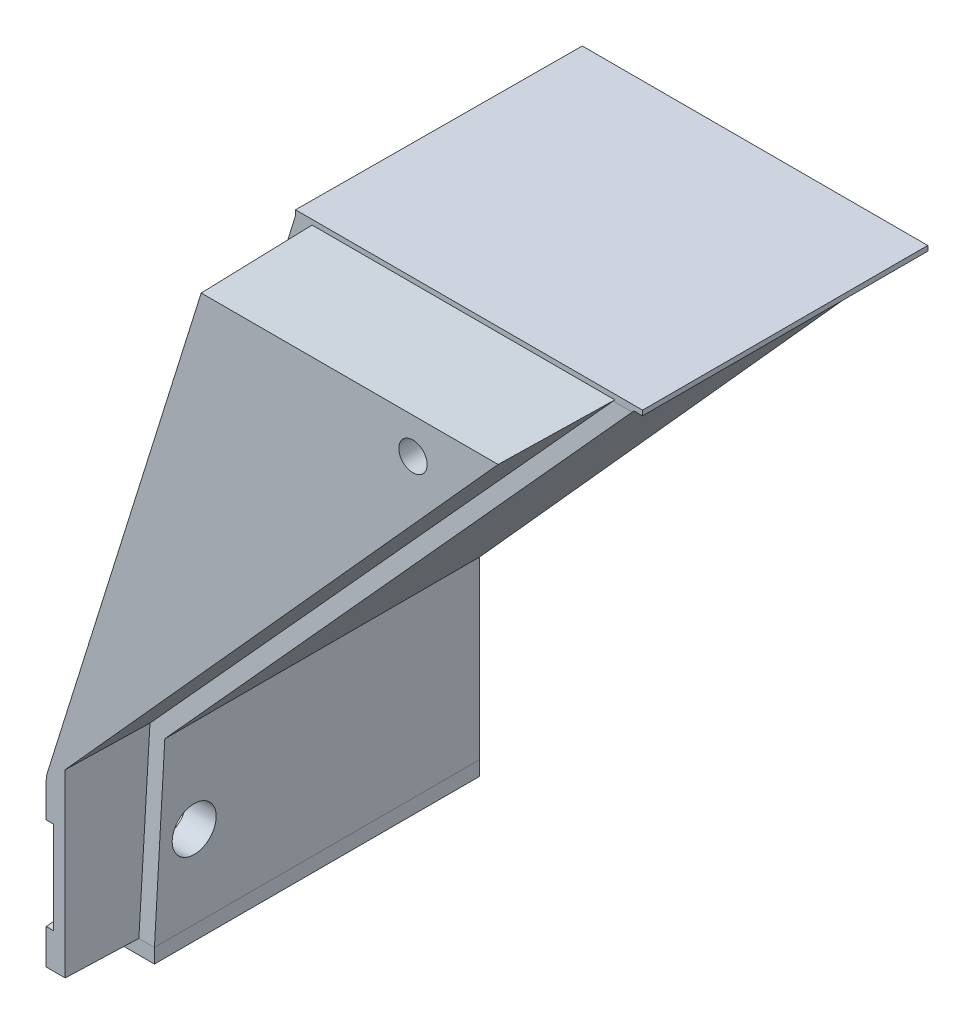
SolidWorks part; units mm, degrees
ref_plane "Plan de face" through (0, 0, 0) normal (0, 0, 1) x (1, 0, 0)
ref_plane "Plan de dessus" through (0, 0, 0) normal (0, 1, 0) x (1, 0, 0)
ref_plane "Plan de droite" through (0, 0, 0) normal (1, 0, 0) x (0, 0, -1)
imported_body "Importée1"
sketch "Esquisse1" plane through (0, 0, 0) normal (0, 0, 1) x (1, 0, 0)
  circle A0 centre (75, 33.9925) radius 2
  circle A1 centre (75, 33.9925) radius 3 construction
  circle A2 centre (75, 33.9925) radius 3
  circle A3 centre (32.5, -15) radius 3 construction
  circle A4 centre (32.5, -15) radius 3
  dimension "D1" = 4
extrude "Extrusion1" add sketch "Esquisse1" against normal up to surface (56 mm away)
